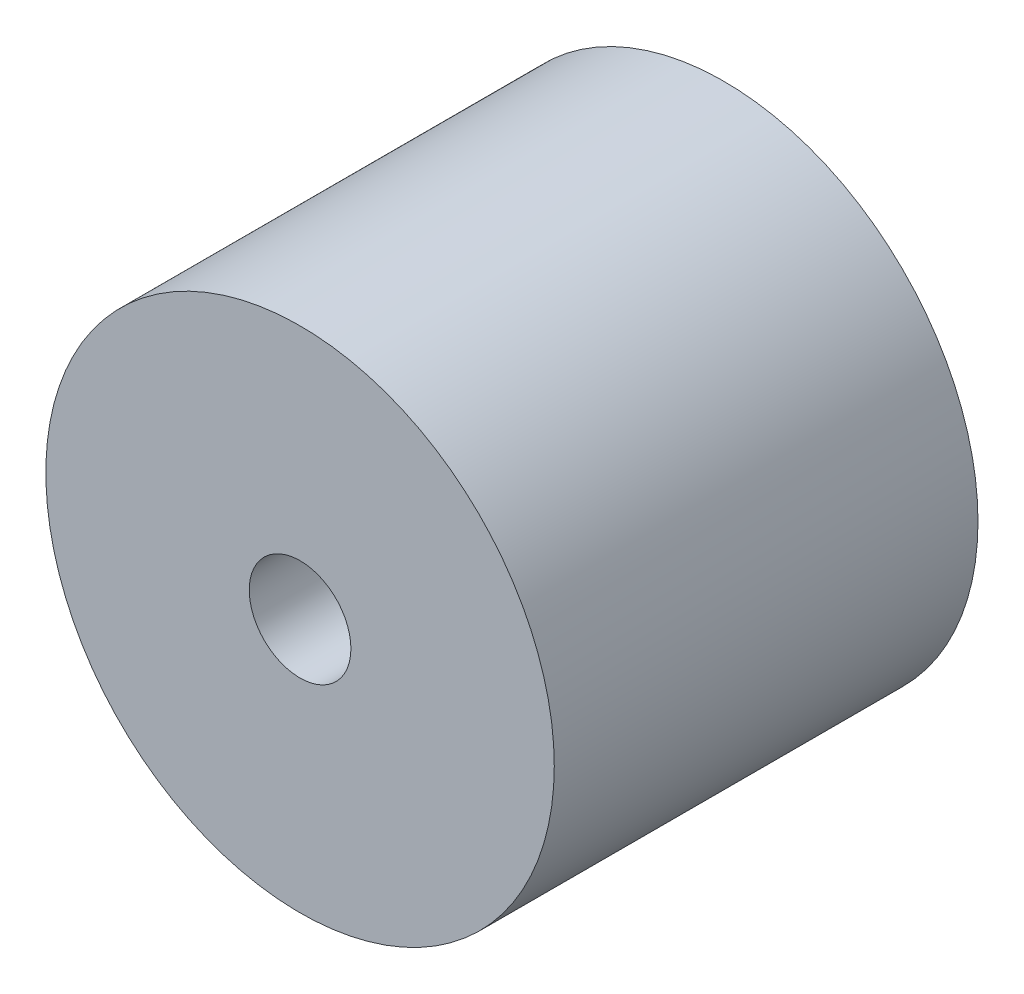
SolidWorks part; units mm, degrees
ref_plane "Face" through (0, 0, 0) normal (0, 0, 1) x (1, 0, 0)
ref_plane "Dessus" through (0, 0, 0) normal (0, 1, 0) x (1, 0, 0)
ref_plane "Droite" through (0, 0, 0) normal (1, 0, 0) x (0, 0, -1)
sketch "Esquisse1" plane through (0, 0, 0) normal (0, 0, 1) x (1, 0, 0)
  circle A0 centre (0, 0) radius 150
  dimension "D1" = 300
extrude "Extrusion1" add sketch "Esquisse1" along normal blind 250
sketch "Esquisse2" plane through (0, 0, 0) normal (0, 1, 0) x (1, 0, 0)
  line L0 (0, 0) -> (-130, 0)
  line L1 (150, 0) -> (-150, 0) construction
  line L2 (-130, 0) -> (-106.906, -40)
  line L3 (-106.906, -40) -> (-86.906, -40)
  line L4 (-86.906, -40) -> (-63.9835, -170)
  line L5 (-63.9835, -170) -> (-30, -170)
  line L6 (-30, -170) -> (-30, -250)
  line L7 (-30, -250) -> (0, -250)
  line L8 (0, -250) -> (0, 0)
  line L9 (-150, -250) -> (150, -250) construction
  line L10 (0, 0) -> (0, 18.0702) construction
  dimension "D1" = 130
  dimension "D2" = 40
  dimension "D3" = 130
  dimension "D4" = 120
  dimension "D5" = 100
  dimension "D6" = 20
  dimension "D7" = 30
revolve "Enlèvement de matière-Révolution1" cut sketch "Esquisse2" angle 360 about L10
